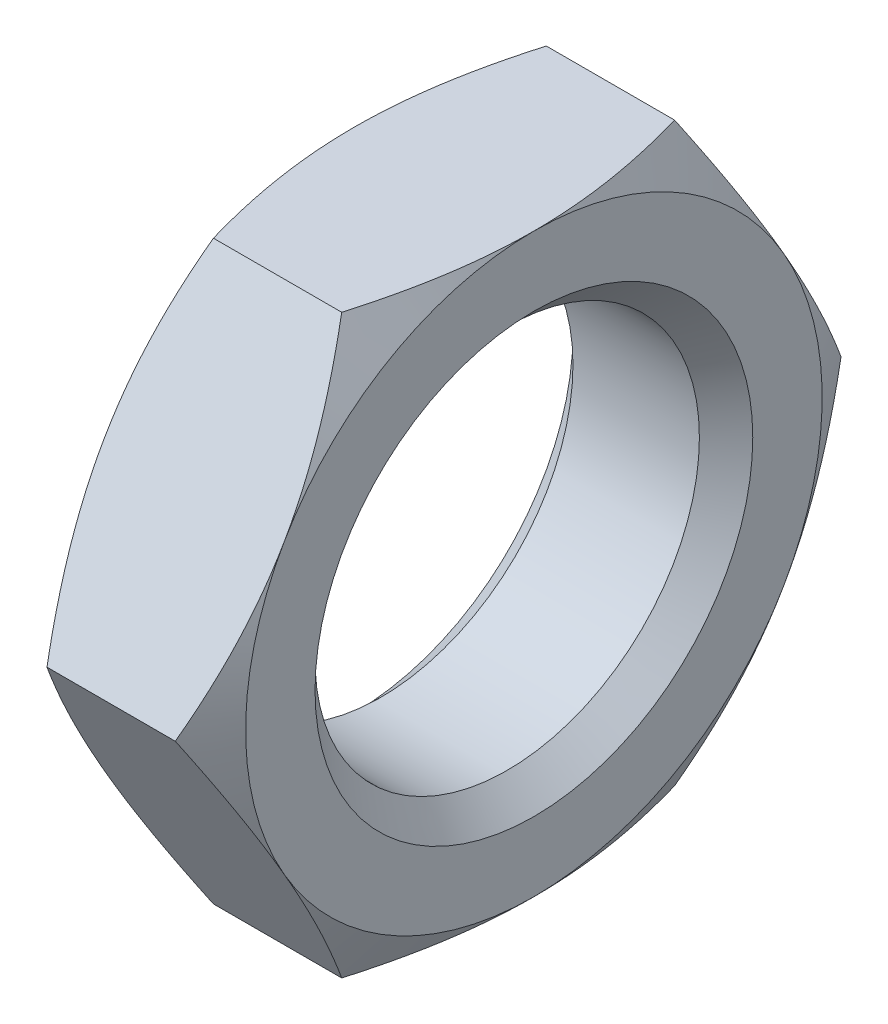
SolidWorks part; units mm, degrees
ref_plane "Front Plane" through (0, 0, 0) normal (0, 0, 1) x (1, 0, 0)
ref_plane "Top Plane" through (0, 0, 0) normal (0, 1, 0) x (1, 0, 0)
ref_plane "Right Plane" through (0, 0, 0) normal (1, 0, 0) x (0, 0, -1)
sketch "Sketch1" plane through (0, 0, 0) normal (1, 0, 0) x (0, 0, -1)
  line L1 (7.7942, 13.5) -> (-7.7942, 13.5)
  line L2 (-7.7942, 13.5) -> (-15.5885, 0)
  line L3 (-15.5885, 0) -> (-7.7942, -13.5)
  line L4 (-7.7942, -13.5) -> (7.7942, -13.5)
  line L5 (7.7942, -13.5) -> (15.5885, 0)
  line L6 (15.5885, 0) -> (7.7942, 13.5)
  circle A0 centre (0, 0) radius 13.5 construction
  circle A1 centre (0, 0) radius 9
extrude "Extrude1" add sketch "Sketch1" along normal blind 8.42
sketch "Sketch2" plane through (0, 0, 0) normal (0, 0, 1) x (1, 0, 0)
  line L0 (8.42, 13.5) -> (8.42, 54)
  line L1 (8.42, 54) -> (0, 54)
  line L2 (0, 54) -> (0, 13.5)
  line L3 (0, 13.5) -> (4.21, 20.7919)
  line L4 (4.21, 20.7919) -> (8.42, 13.5)
revolve "Cut-Revolve1" cut sketch "Sketch2" angle 360 about axis through (8.42, 0, 0) along (-1, 0, 0)
chamfer "Chamfer1" distance 1.25 angle 45 2 edges at (0, 0, -9) (8.42, 0, -9)
equation "\"D2@Sketch2\"=\"D1@Sketch1\"*2"
